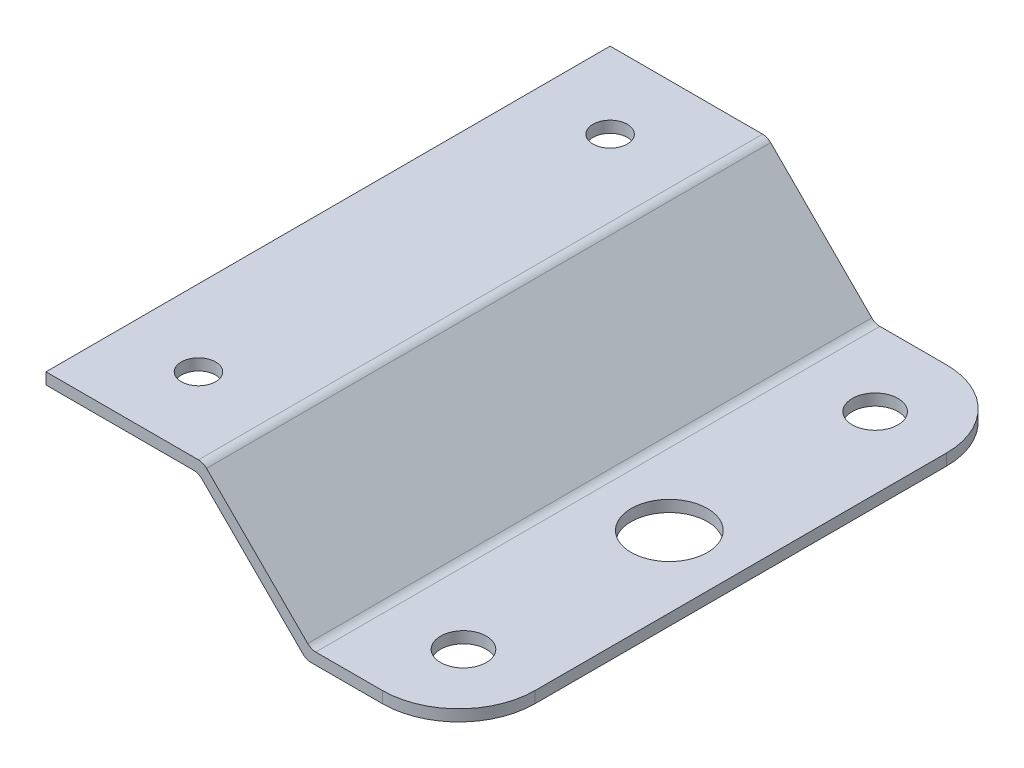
SolidWorks part; units mm, degrees
ref_plane "Front" through (0, 0, 0) normal (0, 0, 1) x (1, 0, 0)
ref_plane "Top" through (0, 0, 0) normal (0, 1, 0) x (1, 0, 0)
ref_plane "Right" through (0, 0, 0) normal (1, 0, 0) x (0, 0, -1)
sketch "Sketch1" plane through (0, 0, 0) normal (0, 0, 1) x (1, 0, 0)
  line L0 (20.4393, -0.4393) -> (33.7028, -13.7028)
  line L1 (0, 0) -> (19.3787, 0)
  line L2 (0, 0) -> (0, 1.5)
  line L3 (0, 1.5) -> (20, 1.5)
  line L6 (21.0607, 1.0607) -> (34.3241, -12.2028)
  line L7 (34.7635, -14.1421) -> (54.1421, -14.1421)
  line L8 (54.1421, -14.1421) -> (54.1421, -12.6421)
  line L9 (54.1421, -12.6421) -> (35.3848, -12.6421)
  arc A0 (34.3241, -12.2028) -> (35.3848, -12.6421) centre (35.3848, -11.1421) ccw
  arc A1 (33.7028, -13.7028) -> (34.7635, -14.1421) centre (34.7635, -12.6421) ccw
  arc A2 (20.4393, -0.4393) -> (19.3787, 0) centre (19.3787, -1.5) ccw
  arc A3 (21.0607, 1.0607) -> (20, 1.5) centre (20, 0) ccw
extrude "Extrude1" add sketch "Sketch1" along normal blind 74
sketch "Sketch2" plane through (0, 1.5, 0) normal (0, 1, 0) x (-1, 0, 0)
  circle A0 centre (-10, 10) radius 2.25
  circle A1 centre (-10, 64) radius 2.25
extrude "Cut-Extrude1" cut sketch "Sketch2" against normal blind 74
sketch "Sketch7" plane through (0, -12.6421, 0) normal (0, 1, 0) x (-1, 0, 0)
  circle A0 centre (-44.7635, 64) radius 3
  circle A1 centre (-44.7635, 10) radius 3
  circle A2 centre (-44.7635, 37) radius 5
extrude "Cut-Extrude2" cut sketch "Sketch7" against normal blind 74 contours A1 | A2 | A0
fillet "Fillet2" radius 10 1 edges at (54.1421, -13.3921, 0)
fillet "Fillet3" radius 10 1 edges at (54.1421, -13.3921, 74)
